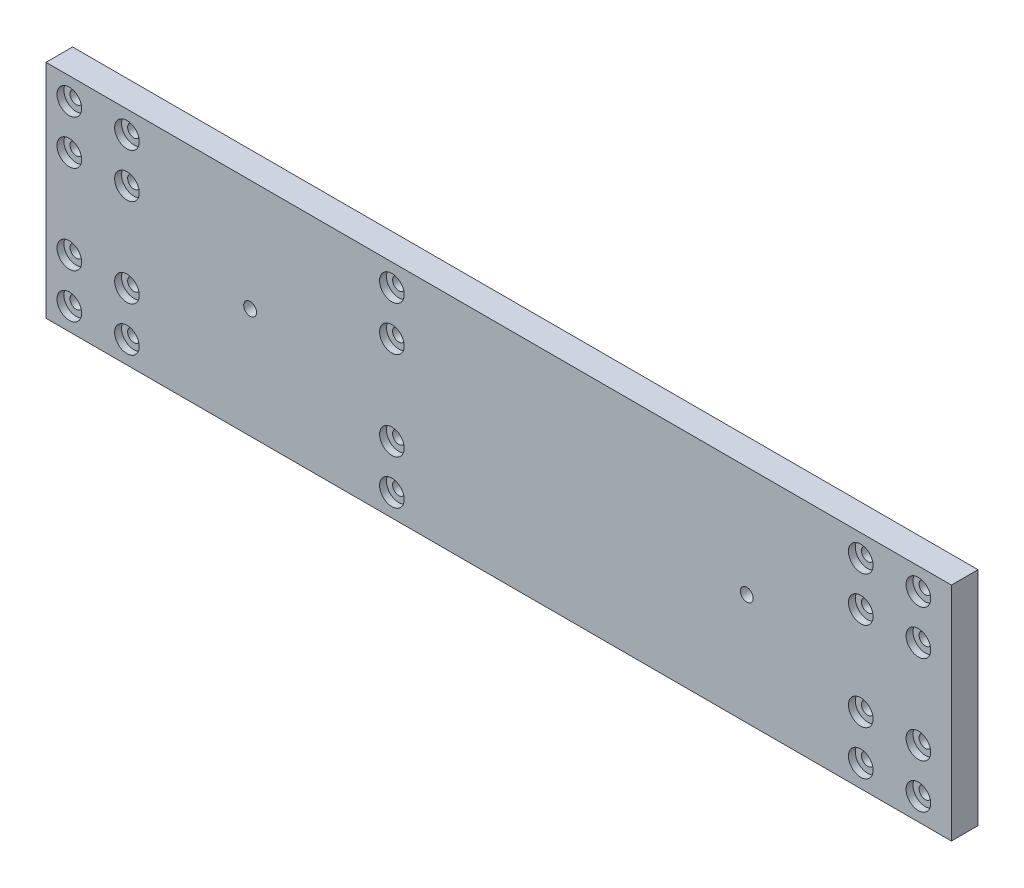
SolidWorks part; units mm, degrees
other "DetailItem1"
ref_plane "Front Plane" through (0, 0, 0) normal (0, 0, 1) x (1, 0, 0)
ref_plane "Top Plane" through (0, 0, 0) normal (0, 1, 0) x (1, 0, 0)
ref_plane "Right Plane" through (0, 0, 0) normal (1, 0, 0) x (0, 0, -1)
sketch "Sketch1" plane through (0, 0, 0) normal (0, 0, 1) x (1, 0, 0)
  line L0 (0, 74.355) -> (0, -78.1465) construction
  line L1 (-124.1708, 0) -> (117.2198, 0) construction
  line L3 (-204.1995, 50) -> (204.1995, 50)
  line L4 (-204.1995, 50) -> (-204.1995, -50)
  line L5 (-204.1995, -50) -> (204.1995, -50)
  line L6 (204.1995, 50) -> (204.1995, -50)
  dimension "D1" = 100
  dimension "D2" = 408.399
extrude "Boss-Extrude1" add sketch "Sketch1" along normal blind 12
sketch "Sketch2" plane through (0, 0, 12) normal (0, 0, 1) x (1, 0, 0)
  line L0 (0, 78.193) -> (0, -94.3708) construction
  line L1 (-204.1995, 0) -> (282.4536, 0) construction
  line L2 (-193.6908, 63.3052) -> (-193.6908, -55.7977) construction
  line L3 (-167.6908, 60.5983) -> (-167.6908, -60.1964) construction
  line L4 (-48.1806, 67.3655) -> (-48.1806, -68.6554) construction
  line L6 (163.3087, 67.3655) -> (163.3087, -73.0541) construction
  line L7 (189.3087, 70.7491) -> (189.3087, -60.1964) construction
  line L10 (-255.2881, 40) -> (287.0065, 40) construction
  line L11 (294.5946, -40) -> (-204.1995, -40) construction
  line L12 (-255.2881, -20) -> (275.3714, -20) construction
  line L13 (270.8186, 20) -> (-193.6908, 20) construction
  line L14 (-204.1995, 50) -> (-204.1995, -50) construction
  dimension "D2" = 26
  dimension "D3" = 237.4893
  dimension "D4" = 189.3087
  dimension "D5" = 356.9995
  dimension "D6" = 26
  dimension "D7" = 20
  dimension "D8" = 20
  dimension "D9" = 20
  dimension "D10" = 20
hole_wizard "CBORE for #10 Binding Head Machine Screw1" positions "3DSketch1" profile "Sketch3" counterbore size "#10" standard "Ansi Inch"
sketch3d "3DSketch1"
  line L0 (-193.6908, 63.3052, 12) -> (-193.6908, -55.7977, 12) construction
  line L1 (-255.2881, 40, 12) -> (287.0065, 40, 12) construction
  line L2 (-167.6908, 60.5983, 12) -> (-167.6908, -60.1964, 12) construction
  line L3 (270.8186, 20, 12) -> (-193.6908, 20, 12) construction
  line L4 (294.5946, -40, 12) -> (-204.1995, -40, 12) construction
  line L5 (-48.1806, 67.3655, 12) -> (-48.1806, -68.6554, 12) construction
  line L7 (-255.2881, -20, 12) -> (275.3714, -20, 12) construction
  line L8 (163.3087, 67.3655, 12) -> (163.3087, -73.0541, 12) construction
  line L9 (189.3087, 70.7491, 12) -> (189.3087, -60.1964, 12) construction
  point P0 (-193.6908, 40, 12)
  point P6 (-167.6908, 40, 12)
  point P10 (-167.6908, 20, 12)
  point P14 (-193.6908, 20, 12)
  point P20 (-167.6908, -40, 12)
  point P26 (-48.1806, 40, 12)
  point P36 (-48.1806, 20, 12)
  point P38 (-48.1806, -20, 12)
  point P42 (-48.1806, -40, 12)
  point P48 (163.3087, 40, 12)
  point P52 (189.3087, 40, 12)
  point P56 (189.3087, 20, 12)
  point P57 (163.3087, 20, 12)
  point P59 (163.3087, -20, 12)
  point P61 (189.3087, -20, 12)
  point P63 (189.3087, -40, 12)
  point P65 (163.3087, -40, 12)
  point P69 (-193.6908, -40, 12)
  point P73 (-167.6908, -20, 12)
  point P77 (-193.6908, -20, 12)
sketch "Sketch3" plane through (-193.6908, 40, 12) normal (1, 0, 0) x (0, -1, 0)
  line L0 (0, 0) -> (0, 12)
  line L1 (0, 12) -> (2.8067, 12)
  line L3 (2.8067, 12) -> (2.8067, 3.1242)
  line L4 (2.8067, 3.1242) -> (5.5562, 3.1242)
  line L5 (5.5562, 3.1242) -> (5.5562, 0)
  line L7 (5.5562, 0) -> (0, 0)
  line L11 (0, -6.35) -> (0, 107.95) construction
  dimension "Thru Hole Dia." = 5.6134
  dimension "Thru Hole Depth" = 12
  dimension "C'Bore Dia." = 11.1125
  dimension "C'Bore Depth" = 3.1242
sketch "Sketch4" plane through (0, 0, 0) normal (0, 0, 1) x (1, 0, 0)
  line L0 (111.9188, 66.3504) -> (111.9188, -65.9485) construction
  line L1 (-111.9188, 72.4409) -> (-111.9187, -91.3427) construction
  line L2 (0, 78.193) -> (0, -94.3708) construction
  line L3 (220.9429, 0) -> (-215.9542, 0) construction
  line L4 (0, -106.9591) -> (0, 131.2594) construction
  dimension "D1" = 111.9188
  dimension "D2" = 111.9188
hole_wizard "CBORE for M5 Hex Head Bolt5" positions "3DSketch6" profile "Sketch11" counterbore size "M5" standard "Ansi Metric"
sketch3d "3DSketch6"
  point P0 (-112.126, -0.2738, 0)
  point P2 (111.9047, 0.0983, 0)
sketch "Sketch11" plane through (-112.126, -0.2738, 0) normal (1, 0, 0) x (0, 1, 0)
  line L0 (0, 0) -> (0, 12)
  line L1 (0, 12) -> (2.9, 12)
  line L3 (2.9, 12) -> (2.9, 3.58)
  line L4 (2.9, 3.58) -> (6.12, 3.58)
  line L5 (6.12, 3.58) -> (6.12, 0)
  line L7 (6.12, 0) -> (0, 0)
  line L11 (0, -6.35) -> (0, 107.95) construction
  dimension "Thru Hole Dia." = 5.8
  dimension "Thru Hole Depth" = 12
  dimension "C'Bore Dia." = 12.24
  dimension "C'Bore Depth" = 3.58
